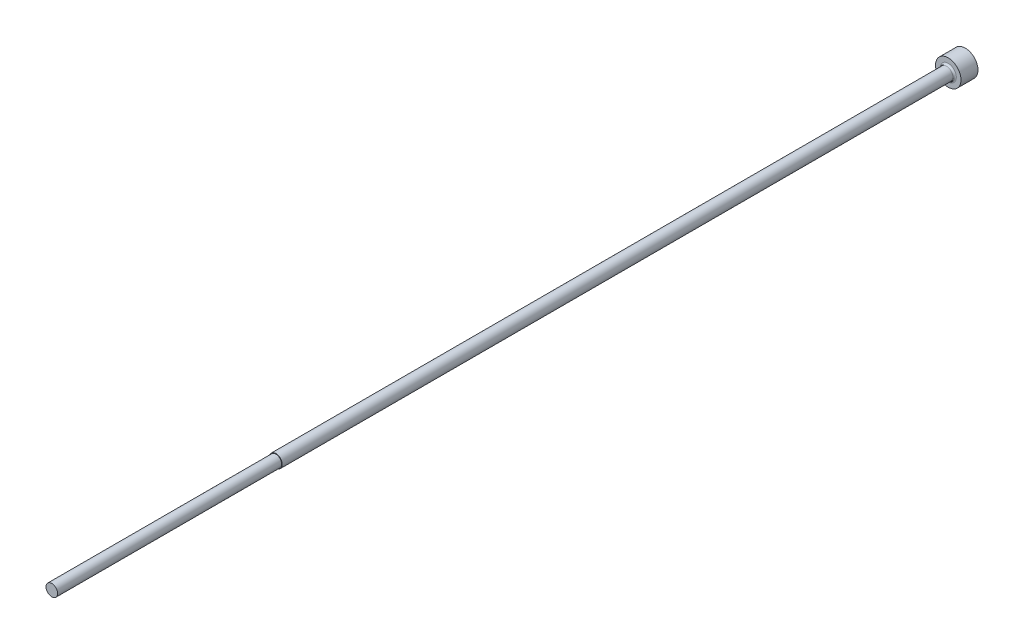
SolidWorks part; units mm, degrees
ref_plane "Face" through (0, 0, 0) normal (0, 0, 1) x (1, 0, 0)
ref_plane "Dessus" through (0, 0, 0) normal (0, 1, 0) x (1, 0, 0)
ref_plane "Droite" through (0, 0, 0) normal (1, 0, 0) x (0, 0, -1)
sketch "Esquisse1" plane through (0, 0, 0) normal (0, 0, 1) x (1, 0, 0)
  circle A0 centre (0, 0) radius 1.5
  dimension "D1" = 3
extrude "Tête" add sketch "Esquisse1" along normal blind 2
sketch "Esquisse2" plane through (0, 0, 2) normal (0, 0, 1) x (1, 0, 0)
  circle A0 centre (0, 0) radius 0.75
  dimension "D1" = 1.5
extrude "Partie active" add sketch "Esquisse2" along normal offset from surface (158 mm away) 160
fillet "Congé1" radius 0.2
sketch "Esquisse3" plane through (0, 0, 160) normal (0, 0, 1) x (1, 0, 0)
  circle A1 centre (0, 0) radius 0.75
  circle A2 centre (0, 0) radius 0.75
  dimension "D1" = 0
extrude "Mise à longueur" cut sketch "Esquisse3" against normal up to surface (52.5101 mm away)
sketch "Esquisse4" plane through (0, 0, 107.4899) normal (0, 0, 1) x (1, 0, 0)
  circle A0 centre (0, 0) radius 0.6841 construction
  circle A1 centre (0, 0) radius 0.6841
extrude "Ajustement au diamètre exact" cut sketch "Esquisse4" against normal up to surface (26.3656 mm away) flip side to cut
